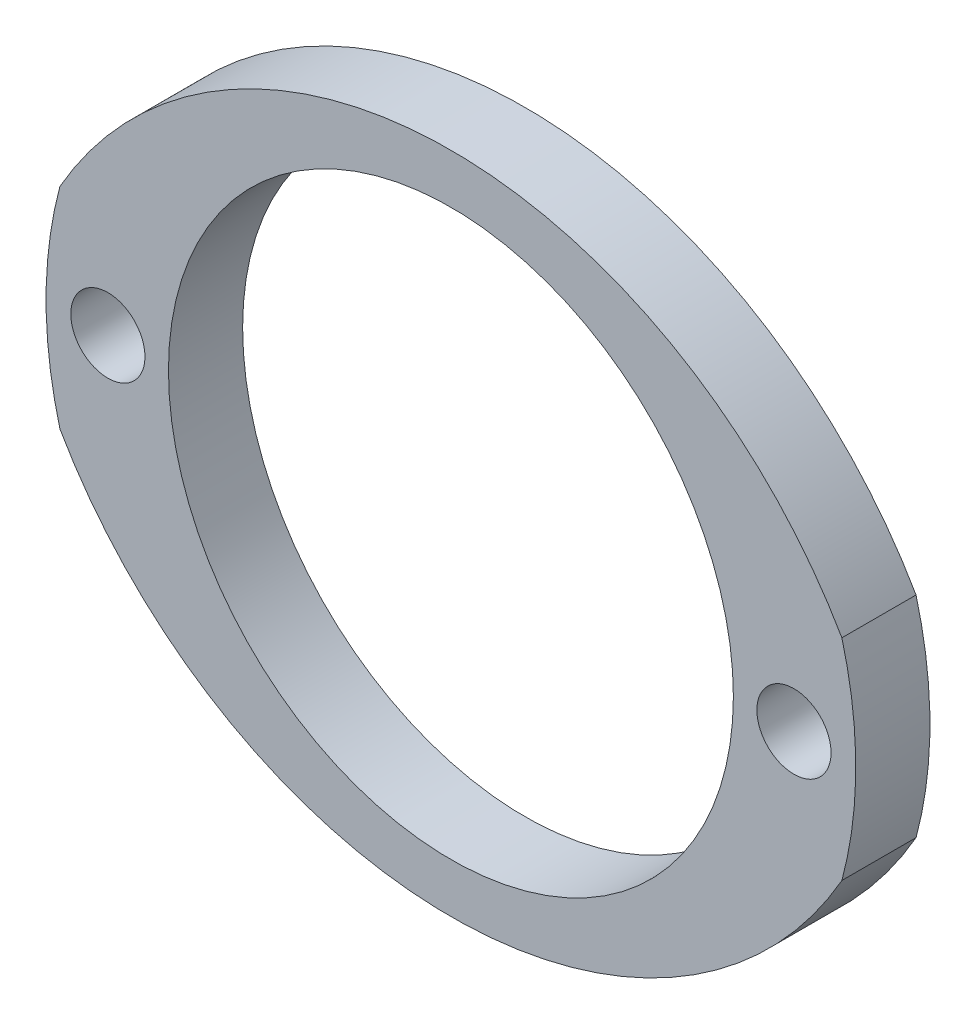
SolidWorks part; units mm, degrees
ref_plane "Front Plane" through (0, 0, 0) normal (0, 0, 1) x (1, 0, 0)
ref_plane "Top Plane" through (0, 0, 0) normal (0, 1, 0) x (1, 0, 0)
ref_plane "Right Plane" through (0, 0, 0) normal (1, 0, 0) x (0, 0, -1)
sketch "Model" plane through (0, 0, 0) normal (0, 0, 1) x (1, 0, 0)
  circle A24 centre (-72.8742, 397.7712) radius 1.5
  circle A25 centre (-100.6242, 397.7712) radius 1.5
  circle A26 centre (-86.7492, 397.7712) radius 11.425
  arc A42 (-102.5631, 402.0214) -> (-102.5631, 393.5211) centre (-86.7492, 397.7712) ccw
  arc A43 (-70.9354, 393.5211) -> (-70.9354, 402.0214) centre (-86.7492, 397.7712) ccw
  arc A44 (-70.9354, 402.0214) -> (-102.5631, 402.0214) centre (-86.7492, 392.9804) ccw
  arc A45 (-102.5631, 393.5211) -> (-70.9354, 393.5211) centre (-86.7492, 402.562) ccw
extrude "Boss-Extrude3" add sketch "Model" along normal blind 3
